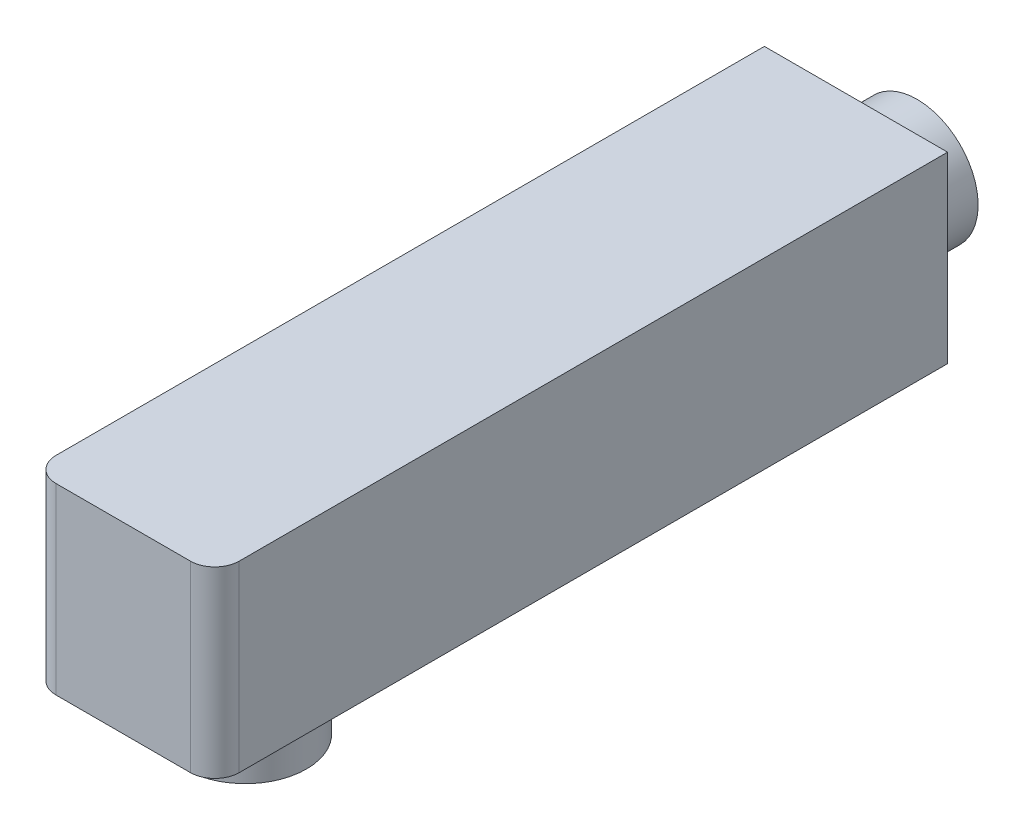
SolidWorks part; units mm, degrees
ref_plane "正面" through (0, 0, 0) normal (0, 0, 1) x (1, 0, 0)
ref_plane "平面" through (0, 0, 0) normal (0, 1, 0) x (1, 0, 0)
ref_plane "右側面" through (0, 0, 0) normal (1, 0, 0) x (0, 0, -1)
sketch "ｽｹｯﾁ1" plane through (0, 0, 0) normal (0, 0, 1) x (1, 0, 0)
  line L1 (0, 0) -> (150, 0)
  line L2 (0, 0) -> (0, 150)
  line L3 (0, 150) -> (150, 150)
  line L4 (150, 0) -> (150, 150)
  dimension "D1" = 150
  dimension "D2" = 150
extrude "押し出し1" add sketch "ｽｹｯﾁ1" along normal blind 600
sketch "ｽｹｯﾁ2" plane through (0, 0, 0) normal (0, 0, -1) x (-1, 0, 0)
  line L0 (-150, 150) -> (0, 150) construction
  line L2 (0, 150) -> (0, 0) construction
  circle A0 centre (-75, 75) radius 50
  dimension "D1" = 100
  dimension "D2" = 75
  dimension "D3" = 75
extrude "押し出し2" add sketch "ｽｹｯﾁ2" along normal blind 50
sketch "ｽｹｯﾁ3" plane through (0, 0, 0) normal (0, -1, 0) x (1, 0, 0)
  line L0 (0, 0) -> (150, 0) construction
  line L1 (150, 600) -> (150, 0) construction
  circle A0 centre (75, 500) radius 50
  dimension "D1" = 100
  dimension "D2" = 500
  dimension "D3" = 75
extrude "押し出し3" add sketch "ｽｹｯﾁ3" along normal blind 50
fillet "ﾌｨﾚｯﾄ1" radius 20 2 edges at (150, 75, 600) (0, 75, 600)
